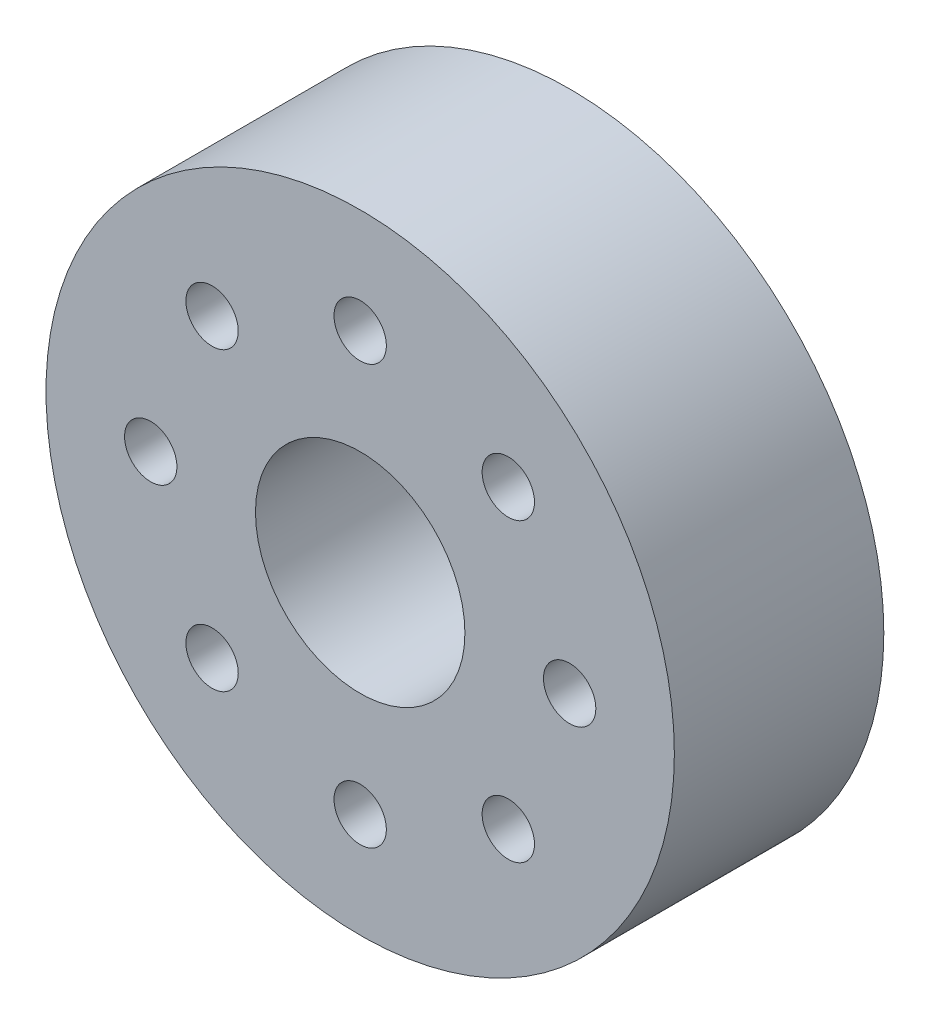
SolidWorks part; units mm, degrees
ref_plane "Front Plane" through (0, 0, 0) normal (0, 0, 1) x (1, 0, 0)
ref_plane "Top Plane" through (0, 0, 0) normal (0, 1, 0) x (1, 0, 0)
ref_plane "Right Plane" through (0, 0, 0) normal (1, 0, 0) x (0, 0, -1)
sketch "Sketch1" plane through (0, 0, 0) normal (0, 0, 1) x (1, 0, 0)
  circle A0 centre (0, 0) radius 4
  circle A1 centre (0, 0) radius 12
  dimension "D1" = 8
  dimension "D2" = 24
extrude "Boss-Extrude1" add sketch "Sketch1" along normal blind 8
sketch "Sketch2" plane through (0, 0, 8) normal (0, 0, 1) x (1, 0, 0)
  line L0 (0, 4) -> (0, 12) construction
  circle A0 centre (0, 0) radius 4 construction
  circle A1 centre (0, 0) radius 12 construction
  circle A2 centre (0, 8) radius 1
  circle A3 centre (8, 0) radius 1
  circle A4 centre (0, -8) radius 1
  circle A5 centre (-8, 0) radius 1
  circle A6 centre (-5.6569, 5.6569) radius 1
  circle A7 centre (0, 8) radius 1
  circle A8 centre (5.6569, 5.6569) radius 1
  circle A9 centre (8, 0) radius 1
  circle A10 centre (5.6569, -5.6569) radius 1
  circle A11 centre (0, -8) radius 1
  circle A12 centre (-5.6569, -5.6569) radius 1
  point P18 (0, 0)
  point P32 (0, 0)
  dimension "D1" = 2
  dimension "D2" = 4
  dimension "D3" = 8
extrude "Cut-Extrude1" cut sketch "Sketch2" against normal through all contours A6 | A2 L0 | A5 | A12 | A4 | A10 | A3 | A8 | L0 A7
